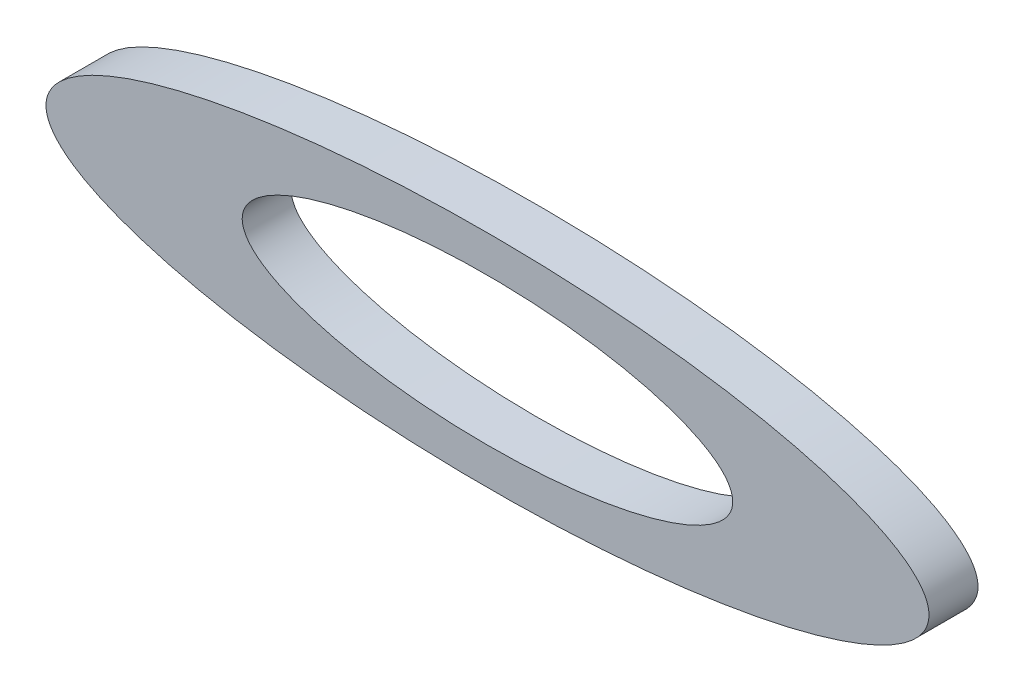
SolidWorks part; units mm, degrees
ref_plane "Front" through (0, 0, 0) normal (0, 0, 1) x (1, 0, 0)
ref_plane "Top" through (0, 0, 0) normal (0, 1, 0) x (1, 0, 0)
ref_plane "Right" through (0, 0, 0) normal (1, 0, 0) x (0, 0, -1)
sketch "Sketch1" plane through (0, 0, 0) normal (0, 0, 1) x (1, 0, 0)
  ellipse E0 centre (0, 0) end of major axis (50, 0) minor radius 15
  ellipse E1 centre (0, 0) end of major axis (90, 0) minor radius 22.5
  dimension "D3" = 45
  dimension "D1" = 30
  dimension "D2" = 100
  dimension "D4" = 180
extrude "Extrude1" add sketch "Sketch1" along normal blind 10
sketch "Sketch2" plane through (0, 0, 10) normal (0, 0, 1) x (1, 0, 0)
  line L0 (-100, -35) -> (100, 35) construction
  line L1 (-100, 35) -> (100, 35)
  line L2 (-100, 35) -> (-100, -35)
  line L3 (-100, -35) -> (100, -35)
  line L4 (100, 35) -> (100, -35)
  ellipse E0 centre (0, 0) end of major axis (-90, 0) minor radius 22.5
  ellipse E2 centre (0, 0) end of major axis (90, 0) minor radius 22.5 construction
  dimension "D1" = 70
  dimension "D2" = 200
